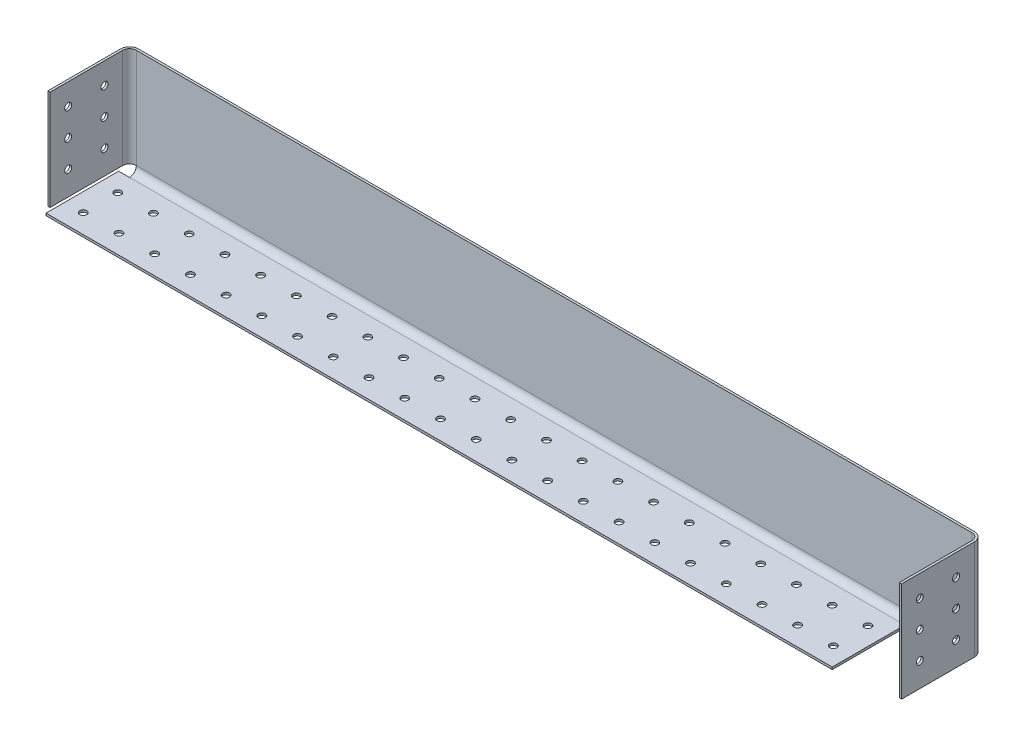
SolidWorks part; units mm, degrees
ref_plane "Front Plane" through (0, 0, 0) normal (0, 0, 1) x (1, 0, 0)
ref_plane "Top Plane" through (0, 0, 0) normal (0, 1, 0) x (1, 0, 0)
ref_plane "Right Plane" through (0, 0, 0) normal (1, 0, 0) x (0, 0, -1)
sketch "Std Pnl Section" plane through (0, 0, 0) normal (0, 0, 1) x (1, 0, 0)
  point P0 (0, 0)
  point P1 (0, 0)
  line B0 (-598.4875, 0) -> (598.4875, 0)
  line B1 (-550.5323, 152.4) -> (-550.5323, 12.7)
  line B2 (-560.0573, 3.175) -> (-646.7475, 3.175)
  line B3 (646.4427, 152.4) -> (646.4427, 12.7)
  line B4 (636.9177, 3.175) -> (550.2275, 3.175)
  line B5 (-598.4875, -1.5875) -> (598.4875, -1.5875)
  line B6 (649.6177, 12.7) -> (649.6177, 152.4)
  line B7 (-646.7475, 0) -> (-560.0573, 0)
  line B8 (-547.3573, 12.7) -> (-547.3573, 152.4)
  arc B9 (646.4427, 12.7) -> (636.9177, 3.175) centre (636.9177, 12.7) cw
  arc B10 (649.6177, 12.7) -> (636.9177, 0) centre (636.9177, 12.7) cw
sketch_block_instance "Block1-3"
sketch_block "Block1"
sketch "side 1 prof" plane through (0, 0, 0) normal (1, 0, 0) x (0, 0, -1)
  line L0 (-50.8, 3.175) -> (50.8, 3.175)
  line L3 (-50.8, 0) -> (50.8, 0)
  line L6 (-50.8, 0) -> (-50.8, 3.175)
  line L17 (60.325, 12.7) -> (60.325, 152.4)
  line L18 (60.325, 152.4) -> (63.5, 152.4)
  line L19 (63.5, 152.4) -> (63.5, 12.7)
  arc A3 (50.8, 3.175) -> (60.325, 12.7) centre (50.8, 12.7) ccw
  arc A10 (50.8, 0) -> (63.5, 12.7) centre (50.8, 12.7) ccw
  point P1 (0, 0)
  point P7 (50.8, 3.4296)
  point P9 (0, 0)
  point P24 (-50.8, 3.175)
  dimension "D1" = 3.175
  dimension "D2" = 9.525
  dimension "D6" = 50.8
  dimension "D5" = 12.7
  dimension "D3" = 3.175
  dimension "D4" = 152.4
  dimension "D7" = 50.8
ref_plane "0.5in offset" through (0, 12.7, 0) normal (0, 1, 0) x (1, 0, 0)
sketch "Sketch4" plane through (0, 12.7, 0) normal (0, 1, 0) x (1, 0, 0)
  line L0 (-547.3573, -50.8) -> (-547.3573, 50.8)
  line L1 (-534.6573, 63.5) -> (633.7427, 63.5)
  line L2 (646.4427, 50.8) -> (646.4427, -50.8)
  line L3 (-544.1823, -50.8) -> (-544.1823, 50.8)
  line L4 (-534.6573, 60.325) -> (633.7427, 60.325)
  line L5 (643.2677, 50.8) -> (643.2677, -50.8)
  line L6 (-547.3573, -50.8) -> (-544.1823, -50.8)
  line L7 (643.2677, -50.8) -> (646.4427, -50.8)
  arc A0 (633.7427, 63.5) -> (646.4427, 50.8) centre (633.7427, 50.8) cw
  arc A1 (-547.3573, 50.8) -> (-534.6573, 63.5) centre (-534.6573, 50.8) cw
  arc A2 (-544.1823, 50.8) -> (-534.6573, 60.325) centre (-534.6573, 50.8) cw
  arc A3 (633.7427, 60.325) -> (643.2677, 50.8) centre (633.7427, 50.8) cw
  point P3 (0, 0)
  point P21 (0, 0)
  point P29 (0, 0)
  point P30 (0, 0)
  dimension "D1" = 12.7
  dimension "D3" = 63.5
  dimension "D2" = 3.175
sketch "Sketch8" plane through (0, 0, 0) normal (0, 1, 0) x (1, 0, 0)
  point P0 (0, 0)
  line B0 (-598.4875, 0) -> (598.4875, 0) construction
  circle B1 centre (-574.3575, 24.13) radius 4.9022
  circle B2 centre (-574.3575, -24.13) radius 4.9022
  circle B3 centre (-524.4134, 24.13) radius 4.9022
  circle B4 centre (-524.4134, -24.13) radius 4.9022
  circle B5 centre (-474.4692, 24.13) radius 4.9022
  circle B6 centre (-474.4692, -24.13) radius 4.9022
  circle B7 centre (-424.5251, 24.13) radius 4.9022
  circle B8 centre (-424.5251, -24.13) radius 4.9022
  circle B9 centre (-374.581, 24.13) radius 4.9022
  circle B10 centre (-374.581, -24.13) radius 4.9022
  circle B11 centre (-324.6368, 24.13) radius 4.9022
  circle B12 centre (-324.6368, -24.13) radius 4.9022
  circle B13 centre (-274.6927, 24.13) radius 4.9022
  circle B14 centre (-274.6927, -24.13) radius 4.9022
  circle B15 centre (-224.7486, 24.13) radius 4.9022
  circle B16 centre (-224.7486, -24.13) radius 4.9022
  circle B17 centre (-174.8045, 24.13) radius 4.9022
  circle B18 centre (-174.8045, -24.13) radius 4.9022
  circle B19 centre (-124.8603, 24.13) radius 4.9022
  circle B20 centre (-124.8603, -24.13) radius 4.9022
  circle B21 centre (-74.9162, 24.13) radius 4.9022
  circle B22 centre (-74.9162, -24.13) radius 4.9022
  circle B23 centre (-24.9721, 24.13) radius 4.9022
  circle B24 centre (-24.9721, -24.13) radius 4.9022
  circle B25 centre (24.9721, 24.13) radius 4.9022
  circle B26 centre (24.9721, -24.13) radius 4.9022
  circle B27 centre (74.9162, 24.13) radius 4.9022
  circle B28 centre (74.9162, -24.13) radius 4.9022
  circle B29 centre (124.8603, 24.13) radius 4.9022
  circle B30 centre (124.8603, -24.13) radius 4.9022
  circle B31 centre (174.8045, 24.13) radius 4.9022
  circle B32 centre (174.8045, -24.13) radius 4.9022
  circle B33 centre (224.7486, 24.13) radius 4.9022
  circle B34 centre (224.7486, -24.13) radius 4.9022
  circle B35 centre (274.6927, 24.13) radius 4.9022
  circle B36 centre (274.6927, -24.13) radius 4.9022
  circle B37 centre (324.6368, 24.13) radius 4.9022
  circle B38 centre (324.6368, -24.13) radius 4.9022
  circle B39 centre (374.581, 24.13) radius 4.9022
  circle B40 centre (374.581, -24.13) radius 4.9022
  circle B41 centre (424.5251, 24.13) radius 4.9022
  circle B42 centre (424.5251, -24.13) radius 4.9022
  circle B43 centre (474.4692, 24.13) radius 4.9022
  circle B44 centre (474.4692, -24.13) radius 4.9022
  circle B45 centre (524.4134, 24.13) radius 4.9022
  circle B46 centre (524.4134, -24.13) radius 4.9022
  circle B47 centre (574.3575, 24.13) radius 4.9022
  circle B48 centre (574.3575, -24.13) radius 4.9022
sketch_block_instance "Std Pnl Holes-1"
sketch_block "Std Pnl Holes" parameters "D3"=9.8044, "D4"=9.8044, "D1"=1196.975, "D2"=24.13, "D5"=24.13, "D6"=24.13
extrude "Boss-Extrude5" add sketch "side 1 prof" along normal up to vertex (633.7427 mm away) and the other way up to vertex (534.6573 mm away)
extrude "Boss-Extrude6" add sketch "Sketch4" along normal blind 139.7
sketch "Sketch9" plane through (0, 0, 0) normal (0, 1, 0) x (1, 0, 0)
  line L1 (549.4338, 69.4733) -> (644.0134, 69.4733)
  line L2 (549.4338, 69.4733) -> (549.4338, -57.31)
  line L3 (549.4338, -57.31) -> (644.0134, -57.31)
  line L4 (644.0134, 69.4733) -> (644.0134, -57.31)
  dimension "D1" = 0.7937
extrude "Cut-Extrude3" cut sketch "Sketch9" along normal blind 12.7
sketch "Sketch10" plane through (0, 0, 0) normal (0, 1, 0) x (1, 0, 0)
  line L0 (549.4338, 50.8) -> (-534.6573, 50.8) construction
  line L1 (-549.8134, 50.8) -> (-534.6573, 50.8)
  line L2 (-549.8134, 50.8) -> (-549.8134, -50.8)
  line L3 (-549.8134, -50.8) -> (-534.6573, -50.8)
  line L4 (-534.6573, 50.8) -> (-534.6573, -50.8)
  line L5 (-534.6573, 50.8) -> (-534.6573, -50.8) construction
  line L6 (549.4338, -50.8) -> (-534.6573, -50.8) construction
  dimension "D1" = 15.1561
extrude "Boss-Extrude7" add sketch "Sketch10" along normal blind 3.175
extrude "Cut-Extrude4" cut sketch "Sketch8" along normal blind 3.175
sketch "Sketch11" plane through (0, 0, 0) normal (1, 0, 0) x (0, 0, -1)
  line L0 (50.8, 0) -> (-50.8, 0) construction
  circle A0 centre (-25.4, 46.355) radius 4.9022
  circle A1 centre (25.4, 46.355) radius 4.9022
  circle A46 centre (-25.4, 84.2545) radius 4.9022
  circle A47 centre (25.4, 84.2545) radius 4.9022
  circle A48 centre (-25.4, 122.1539) radius 4.9022
  circle A49 centre (25.4, 122.1539) radius 4.9022
  dimension "D2" = 9.8044
  dimension "D3" = 9.8044
  dimension "D1" = 46.355
  dimension "D4" = 25.4
  dimension "D5" = 25.4
  dimension "D6" = 3
extrude "Cut-Extrude5" cut sketch "Sketch11" against normal through all both and the other way through all
